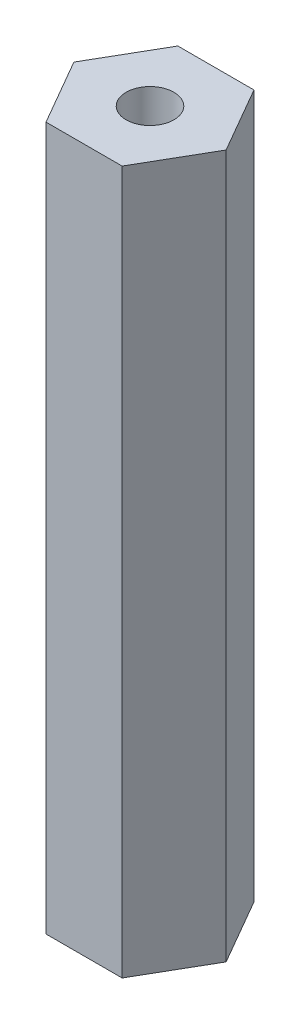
SolidWorks part; units mm, degrees
ref_plane "Front" through (0, 0, 0) normal (0, 0, 1) x (1, 0, 0)
ref_plane "Top" through (0, 0, 0) normal (0, 1, 0) x (1, 0, 0)
ref_plane "Right" through (0, 0, 0) normal (1, 0, 0) x (0, 0, -1)
sketch "Sketch1" plane through (0, 0, 0) normal (0, 1, 0) x (1, 0, 0)
  line L1 (5.4993, 0) -> (2.7496, 4.7625)
  line L2 (2.7496, 4.7625) -> (-2.7496, 4.7625)
  line L3 (-2.7496, 4.7625) -> (-5.4993, 0)
  line L4 (-5.4993, 0) -> (-2.7496, -4.7625)
  line L5 (-2.7496, -4.7625) -> (2.7496, -4.7625)
  line L6 (2.7496, -4.7625) -> (5.4993, 0)
  circle A1 centre (0, 0) radius 4.7625 construction
  dimension "D1" = 9.525
extrude "Base-Extrude" add sketch "Sketch1" along normal blind 50.8
hole_wizard "#8-32 Tapped Hole1" positions "Sketch4" profile "Sketch3" tap size "#8-32" standard "Ansi Inch"
sketch "Sketch4" plane through (0, 50.8, 0) normal (0, 1, 0) x (-1, 0, 0)
  point P0 (0, 0)
sketch "Sketch3" plane through (0, 50.8, 0) normal (1, 0, 0) x (0, 0, 1)
  line L0 (0, 0) -> (0, 14.9062)
  line L1 (0, 14.9062) -> (1.7272, 13.8684)
  line L2 (1.7272, 13.8684) -> (1.7272, 0)
  line L5 (1.7272, 0) -> (0, 0)
  line L10 (0, 14.9062) -> (-1.7272, 13.8684) construction
  line L11 (0, -6.35) -> (0, 107.95) construction
  dimension "Tap Drill Dia." = 3.4544
  dimension "Tap Drill Depth" = 13.8684
  dimension "Drill Angle" = 118
hole_wizard "#8-32 Tapped Hole2" positions "Sketch6" profile "Sketch5" tap size "#8-32" standard "Ansi Inch"
sketch "Sketch6" plane through (0, 0, 0) normal (0, -1, 0) x (1, 0, 0)
  point P0 (0, 0)
sketch "Sketch5" plane through (0, 0, 0) normal (1, 0, 0) x (0, 0, -1)
  line L0 (0, 0) -> (0, 14.9062)
  line L1 (0, 14.9062) -> (1.7272, 13.8684)
  line L2 (1.7272, 13.8684) -> (1.7272, 0)
  line L5 (1.7272, 0) -> (0, 0)
  line L10 (0, 14.9062) -> (-1.7272, 13.8684) construction
  line L11 (0, -6.35) -> (0, 107.95) construction
  dimension "Tap Drill Dia." = 3.4544
  dimension "Tap Drill Depth" = 13.8684
  dimension "Drill Angle" = 118
